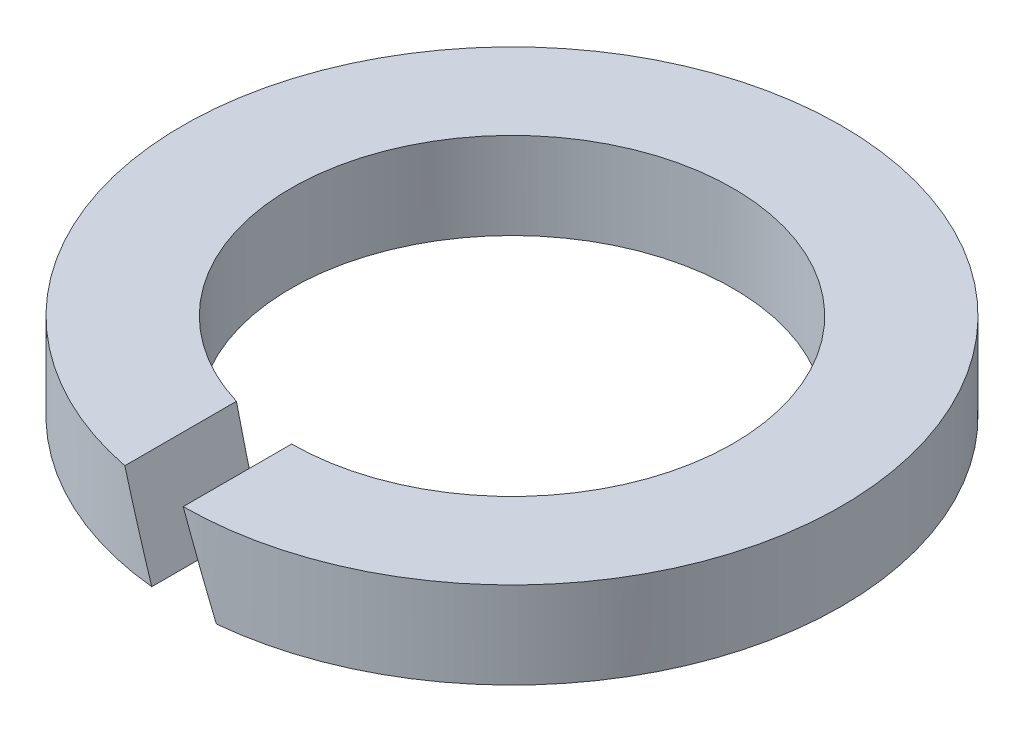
SolidWorks part; units mm, degrees
ref_plane "Спереди" through (0, 0, 0) normal (0, 0, 1) x (1, 0, 0)
ref_plane "Сверху" through (0, 0, 0) normal (0, 1, 0) x (1, 0, 0)
ref_plane "Справа" through (0, 0, 0) normal (1, 0, 0) x (0, 0, -1)
sketch "Ske" plane through (0, 0, 0) normal (0, 0, 1) x (1, 0, 0)
  line L0 (0, 15.7597) -> (0, -13.7032) construction
  line L1 (-5.1, 0) -> (-7.6, 0)
  line L2 (-5.1, 0) -> (-5.1, 2)
  line L3 (-5.1, 2) -> (-7.6, 2)
  line L4 (-7.6, 0) -> (-7.6, 2)
revolve "Base" add sketch "Ske" angle 360 about L0
sketch "Ske4" plane through (0, 0, 0) normal (0, 0, 1) x (1, 0, 0)
  line L0 (0, 0) -> (-0.6869, 1.8873) construction
  line L1 (-5.1, 0) -> (5.1, 0) construction
  line L2 (5.1, 2) -> (-5.1, 2) construction
  line L3 (-0.7449, 0) -> (0.7449, 0)
  line L4 (0.017, 2) -> (-1.4729, 2)
  line L5 (0.017, 2) -> (0.7449, 0)
  line L6 (-1.4729, 2) -> (-0.7449, 0)
extrude "Cut" cut sketch "Ske4" along normal up to next
equation "\"D2@Ske4\"=0.7*\"H@Ske\""
